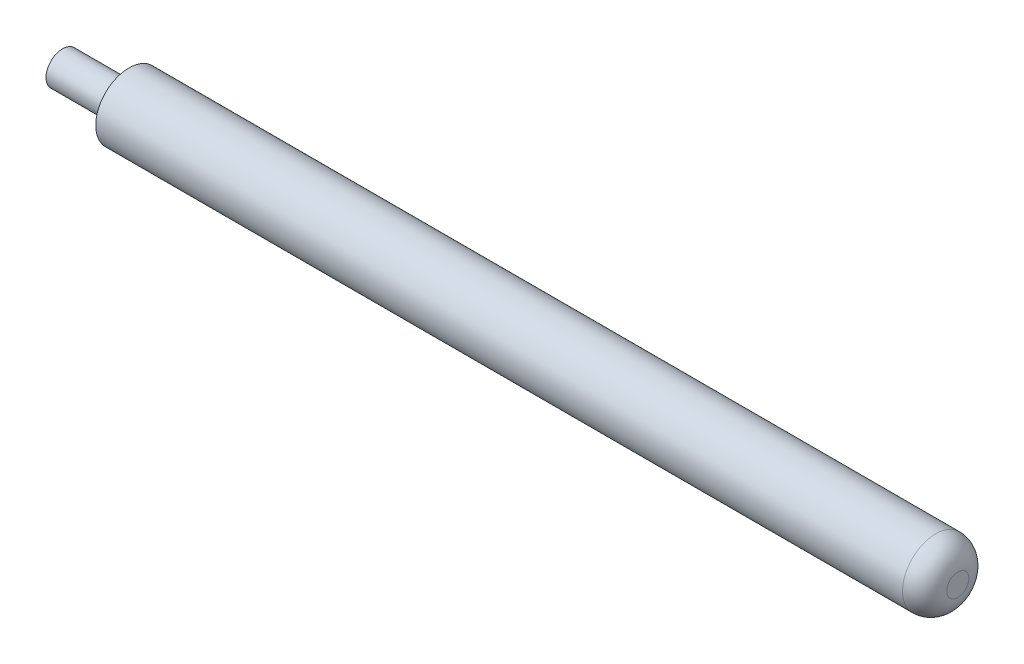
SolidWorks part; units mm, degrees
ref_plane "Front Plane" through (0, 0, 0) normal (0, 0, 1) x (1, 0, 0)
ref_plane "Top Plane" through (0, 0, 0) normal (0, 1, 0) x (1, 0, 0)
ref_plane "Right Plane" through (0, 0, 0) normal (1, 0, 0) x (0, 0, -1)
sketch "Sketch1" plane through (0, 0, 0) normal (1, 0, 0) x (0, 0, -1)
  circle A0 centre (0, 0) radius 3
  dimension "D1" = 6
extrude "Extrude1" add sketch "Sketch1" along normal blind 75
sketch "Sketch2" plane through (0, 0, 0) normal (-1, 0, 0) x (0, 0, 1)
  circle A0 centre (0, 0) radius 1.5
  dimension "D1" = 3
extrude "Extrude2" add sketch "Sketch2" along normal blind 6
fillet "Fillet1" radius 2 1 edges at (75, 0, -3)
